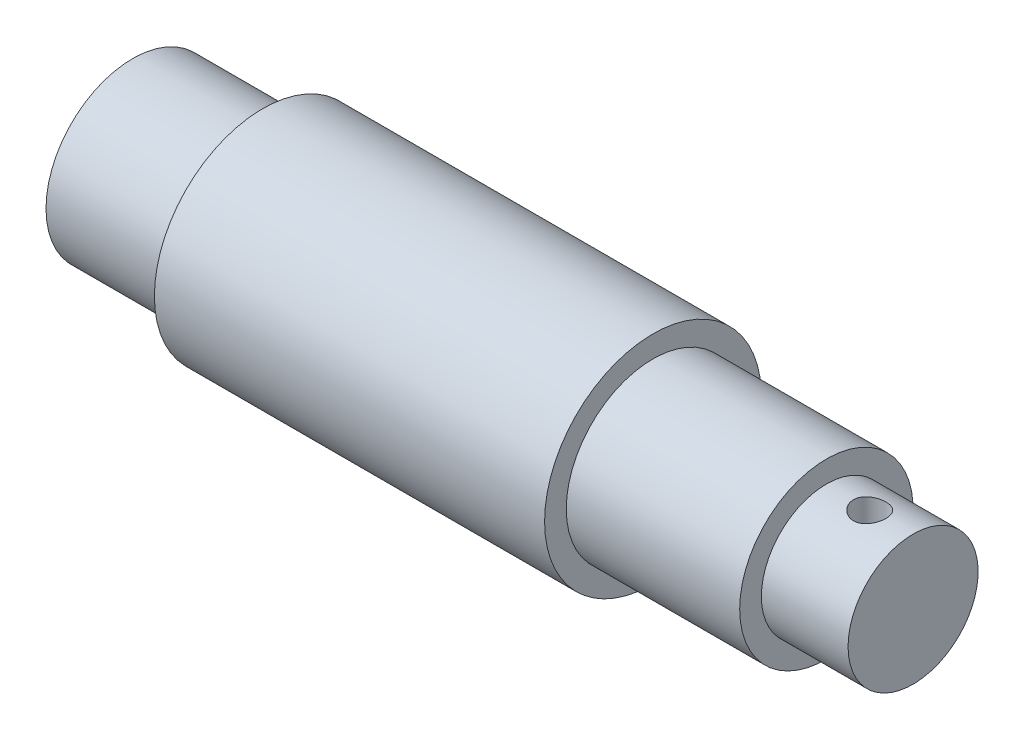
SolidWorks part; units mm, degrees
ref_plane "Front Plane" through (0, 0, 0) normal (0, 0, 1) x (1, 0, 0)
ref_plane "Top Plane" through (0, 0, 0) normal (0, 1, 0) x (1, 0, 0)
ref_plane "Right Plane" through (0, 0, 0) normal (1, 0, 0) x (0, 0, -1)
sketch "Sketch1" plane through (0, 0, 0) normal (0, 0, 1) x (1, 0, 0)
  line L0 (0, 0) -> (104.988, 0) construction
  line L1 (0, 0) -> (0, 6.35)
  line L2 (0, 6.35) -> (9.525, 6.35)
  line L3 (50.8, 6.35) -> (50.8, 4.7625)
  line L4 (50.8, 4.7625) -> (57.15, 4.7625)
  line L5 (57.15, 4.7625) -> (57.15, 0)
  line L6 (57.15, 0) -> (0, 0)
  line L7 (38.1, 6.35) -> (38.1, 7.9375)
  line L8 (38.1, 7.9375) -> (9.525, 7.9375)
  line L9 (9.525, 7.9375) -> (9.525, 6.35)
  line L10 (38.1, 6.35) -> (50.8, 6.35)
  dimension "D1" = 12.7
  dimension "D2" = 9.525
  dimension "D3" = 50.8
  dimension "D4" = 6.35
  dimension "D5" = 15.875
  dimension "D6" = 12.7
  dimension "D7" = 28.575
revolve "Revolve1" add sketch "Sketch1" angle 360 about L0
sketch "Sketch2" plane through (0, 0, 0) normal (0, 1, 0) x (1, 0, 0)
  line L0 (57.15, -4.7625) -> (57.15, 4.7625) construction
  circle A0 centre (53.975, 0) radius 1.1906
  dimension "D1" = 2.3813
  dimension "D2" = 3.175
extrude "Cut-Extrude1" cut sketch "Sketch2" against normal through all and the other way through all
